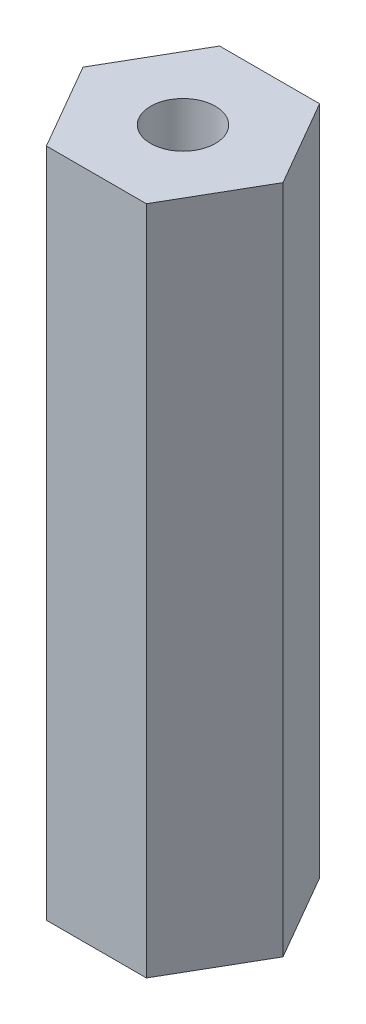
SolidWorks part; units mm, degrees
ref_plane "Front Plane" through (0, 0, 0) normal (0, 0, 1) x (1, 0, 0)
ref_plane "Top Plane" through (0, 0, 0) normal (0, 1, 0) x (1, 0, 0)
ref_plane "Right Plane" through (0, 0, 0) normal (1, 0, 0) x (0, 0, -1)
sketch "Sketch1" plane through (0, 0, 0) normal (0, 1, 0) x (1, 0, 0)
  line L1 (4.3994, 0) -> (2.1997, 3.81)
  line L2 (2.1997, 3.81) -> (-2.1997, 3.81)
  line L3 (-2.1997, 3.81) -> (-4.3994, 0)
  line L4 (-4.3994, 0) -> (-2.1997, -3.81)
  line L5 (-2.1997, -3.81) -> (2.1997, -3.81)
  line L6 (2.1997, -3.81) -> (4.3994, 0)
  circle A0 centre (0, 0) radius 3.81 construction
extrude "Boss-Extrude1" add sketch "Sketch1" along normal blind 29.5
sketch "Sketch2" plane through (0, 0, 0) normal (0, -1, 0) x (-1, 0, 0)
  circle A0 centre (0, 0) radius 1.4224
extrude "Cut-Extrude1" cut sketch "Sketch2" against normal through all
equation "\"D1@Boss-Extrude1\"=29.5mm"
equation "\"D1@Sketch2\"=.112"
